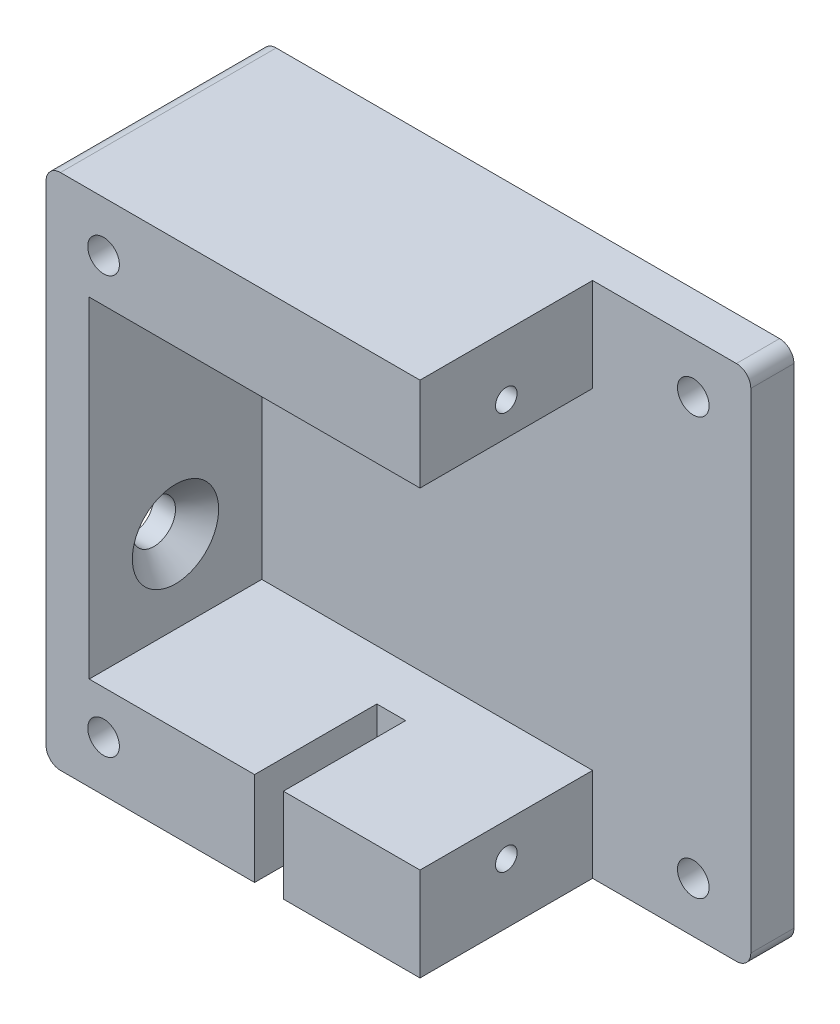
SolidWorks part; units mm, degrees
ref_plane "Спереди" through (0, 0, 0) normal (0, 0, 1) x (1, 0, 0)
ref_plane "Сверху" through (0, 0, 0) normal (0, 1, 0) x (1, 0, 0)
ref_plane "Справа" through (0, 0, 0) normal (1, 0, 0) x (0, 0, -1)
sketch "Эскиз1" plane through (0, 0, 0) normal (0, 0, 1) x (1, 0, 0)
  line L1 (-18.5, -18) -> (18.5, -18)
  line L2 (-18.5, -18) -> (-18.5, 18)
  line L3 (-18.5, 18) -> (18.5, 18)
  line L4 (18.5, -18) -> (18.5, 18)
  line L5 (-18.5, -18) -> (18.5, 18) construction
  line L6 (-18.5, 18) -> (18.5, -18) construction
  point P0 (0, 0)
  dimension "D1" = 37
  dimension "D2" = 36
extrude "тело" add sketch "Эскиз1" along normal blind 3
sketch "Эскиз2" plane through (0, 0, 3) normal (0, 0, 1) x (1, 0, 0)
  line L0 (7.5, 18) -> (-18.5, 18)
  line L1 (18.5, 18) -> (-18.5, 18) construction
  line L2 (-18.5, 18) -> (-18.5, -18)
  line L3 (-18.5, -18) -> (7.5, -18)
  line L4 (-18.5, -18) -> (18.5, -18) construction
  line L5 (7.5, -18) -> (7.5, -11.5)
  line L6 (7.5, -11.5) -> (-8.8, -11.5)
  line L7 (-8.8, -11.5) -> (-8.8, 11.5) construction
  line L8 (-8.8, 11.5) -> (7.5, 11.5)
  line L9 (7.5, 11.5) -> (7.5, 18)
  line L10 (18.5, -18) -> (18.5, 18) construction
  line L11 (-8.8, 11.5) -> (-15.5, 11.5)
  line L12 (-15.5, 11.5) -> (-15.5, -11.5)
  line L13 (-15.5, -11.5) -> (-8.8, -11.5)
  dimension "D1" = 11
  dimension "D2" = 16.3
  dimension "D3" = 23
  dimension "D4" = 3
extrude "крепление сервы" add sketch "Эскиз2" along normal blind 12
sketch "Эскиз4" plane through (-15.5, 0, 0) normal (1, 0, 0) x (0, 0, -1)
  line L0 (-9, 11.5) -> (-9, -11.5) construction
  line L1 (-15, 11.5) -> (-3, 11.5) construction
  line L2 (-15, -11.5) -> (-3, -11.5) construction
  circle A0 centre (-9, -5.77) radius 1.5
  dimension "D1" = 3
  dimension "D2" = 5.77
extrude "отверстие под выход второй оси" cut sketch "Эскиз4" against normal through all
chamfer "Фаска1" distance 1.5 angle 45 1 edges at (-15.5, -4.27, 9)
sketch "Эскиз3" plane through (7.5, 0, 0) normal (1, 0, 0) x (0, 0, -1)
  line L0 (-9, 18) -> (-9, 11.5) construction
  line L1 (-15, 18) -> (-3, 18) construction
  line L2 (-15, 11.5) -> (-3, 11.5) construction
  circle A0 centre (-9, 13.82) radius 0.75
  point P17 (-9, -5.77)
  dimension "D1" = 1.5
  dimension "D2" = 2.32
extrude "отверстие под саморез" cut sketch "Эскиз3" against normal blind 10
mirror "Зеркальное отражение2" about plane through (0, 0, 0) normal (0, 1, 0) of "отверстие под саморез"
sketch "Эскиз5" plane through (0, -18, 0) normal (0, -1, 0) x (1, 0, 0)
  line L0 (-18.5, 15) -> (7.5, 15) construction
  line L1 (-4, 15) -> (-2, 15)
  line L2 (-4, 15) -> (-4, 6.5)
  line L3 (-4, 6.5) -> (-2, 6.5)
  line L4 (-2, 15) -> (-2, 6.5)
  line L5 (7.5, 15) -> (7.5, 3) construction
  dimension "D1" = 2
  dimension "D2" = 9.5
  dimension "D3" = 8.5
extrude "паз для проводов" cut sketch "Эскиз5" against normal up to surface (6.5 mm away)
sketch "Эскиз6" plane through (0, 0, 0) normal (0, 0, -1) x (-1, 0, 0)
  line L0 (0, 18) -> (0, -18) construction
  line L1 (-18.5, 18) -> (18.5, 18) construction
  line L2 (18.5, -18) -> (-18.5, -18) construction
  line L4 (-14.5, -14.5) -> (14.5, -14.5) construction
  line L5 (-14.5, -14.5) -> (-14.5, 14.5) construction
  line L6 (-14.5, 14.5) -> (14.5, 14.5) construction
  line L7 (14.5, -14.5) -> (14.5, 14.5) construction
  line L8 (-14.5, -14.5) -> (14.5, 14.5) construction
  line L9 (-14.5, 14.5) -> (14.5, -14.5) construction
  circle A0 centre (-14.5, 14.5) radius 1.1
  circle A1 centre (14.5, 14.5) radius 1.1
  circle A2 centre (14.5, -14.5) radius 1.1
  circle A3 centre (-14.5, -14.5) radius 1.1
  point P6 (0, 0)
  dimension "D1" = 2.2
  dimension "D2" = 29
  dimension "D3" = 29
extrude "крепление камеры" cut sketch "Эскиз6" against normal through all
chamfer "Фаска2" [suppressed] distance 1 angle 45
fillet "Скругление1" radius 1 4 edges at (18.5, 18, 1.5) (18.5, -18, 1.5) (-18.5, -18, 7.5) (-18.5, 18, 7.5)
